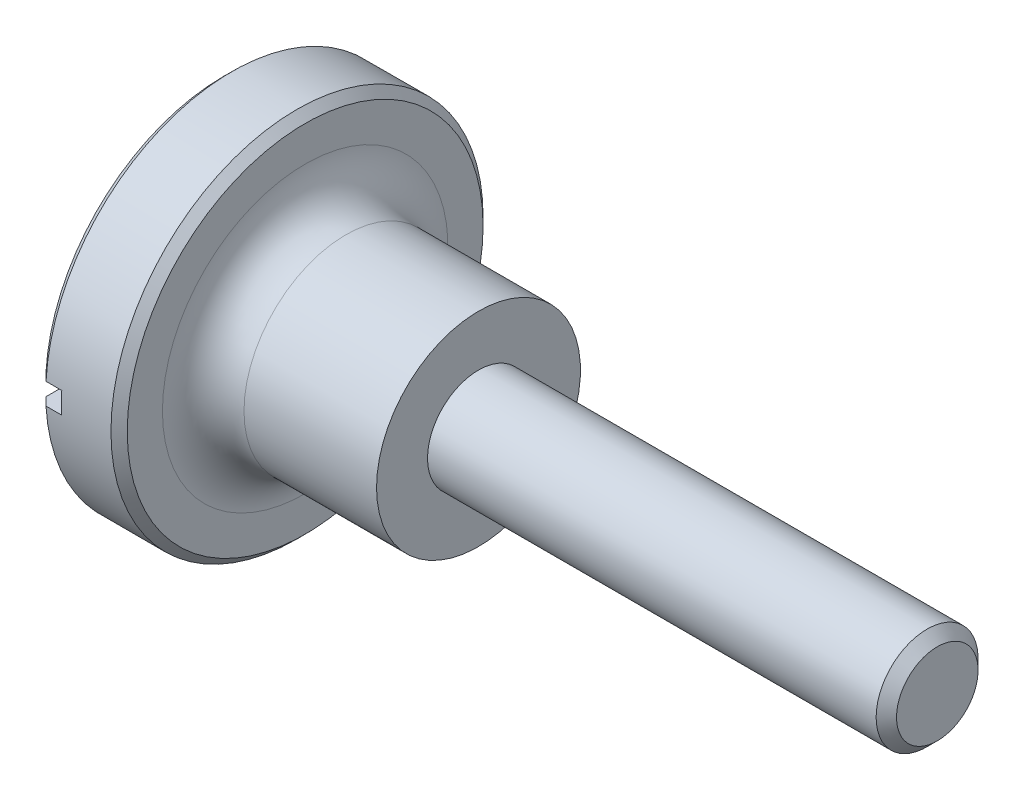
SolidWorks part; units mm, degrees
ref_plane "Plane1" through (0, 0, 0) normal (0, 0, 1) x (1, 0, 0)
ref_plane "Plane2" through (0, 0, 0) normal (0, 1, 0) x (1, 0, 0)
ref_plane "Plane3" through (0, 0, 0) normal (1, 0, 0) x (0, 0, -1)
sketch "BodySke" plane through (0, 0, 0) normal (0, 0, 1) x (1, 0, 0)
  line L0 (69, 5) -> (70, 4)
  line L1 (0, 0) -> (0, 17.45)
  line L2 (-25.4, 0) -> (127, 0) construction
  line L3 (70, 0) -> (0, 0)
  line L5 (70, 4) -> (70, 0)
  line L6 (0.8, 18.25) -> (7.2, 18.25)
  line L7 (4, 31.75) -> (4, -6.35) construction
  line L8 (0.8, 18.25) -> (0, 17.45)
  line L9 (10, 6.5875) -> (10, -2.9375) construction
  line L10 (30, 6.35) -> (30, -3.175) construction
  line L11 (7.2, 18.25) -> (8, 17.45)
  line L12 (8, 10) -> (25, 10)
  line L13 (25, 10) -> (25, 5)
  line L14 (25, 5) -> (69, 5)
  line L15 (8, 10) -> (8, 17.45)
  point P9 (70, 5)
  dimension "D1" = 45
  dimension "D3" = 45
  dimension "Head_ht" = 8
  dimension "Length" = 45
  dimension "Head_dia" = 36.5
  dimension "Advance" = 2
  dimension "Thread_nom" = 40
  dimension "Chamfer" = 0.8
  dimension "Shoulder" = 25
  dimension "diameter" = 10
  dimension "Ds" = 20
  dimension "Minor_dia" = 8
revolve "Base-Revolve" add sketch "BodySke" angle 360 about L2
sketch "ThdSchSke" plane through (0, 0, 0) normal (0, 0, 1) x (1, 0, 0)
  line L0 (30, -4) -> (29.2998, -5)
  line L1 (30, -4) -> (30.7002, -5)
  line L2 (30.7002, -5) -> (30.7002, -6.25)
  line L3 (-3.175, 0) -> (5.1513, 0) construction
  line L5 (30.7002, -6.25) -> (29.2998, -6.25)
  line L6 (29.2998, -6.25) -> (29.2998, -5)
  line L7 (25, -10) -> (25, 10) construction
  dimension "Thread_minor" = 8
  dimension "Diameter" = 10
  dimension "Start" = 5
  dimension "SideAngle" = 55
  dimension "VeeAngle" = 70
  dimension "Overcut" = 12.5
revolve "ThreadSchematic" [suppressed] cut sketch "ThdSchSke" angle 360 about L3
pattern_linear "ThdSchPat" [suppressed]
sketch "KnurlSke" plane through (0, 0, 0) normal (-1, 0, 0) x (0, 0, 1)
  line L0 (0, 17.65) -> (0, 3.175) construction
  line L1 (0, 17.65) -> (0.3445, 18.2467)
  line L2 (0, 17.65) -> (-0.3445, 18.2467)
  line L3 (0, 18.25) -> (0, 17.65) construction
  circle A0 centre (0, 0) radius 18.25 construction
  arc A1 (0.3445, 18.2467) -> (-0.3445, 18.2467) centre (0, 0) ccw
  dimension "D2" = 60
  dimension "depth" = 0.6
extrude "Knurl_cut" [suppressed] cut sketch "KnurlSke" against normal up to next
pattern_circular "Knurl" [suppressed] count 86 over 360 about axis through (-25.4, 0, 0) along (1, 0, 0)
sketch "SlotSke" plane through (0, 0, 0) normal (0, 0, 1) x (1, 0, 0)
  line L0 (2.3466, 1.0507) -> (-2.3466, -1.0507) construction
  line L1 (-2.3466, -1.0507) -> (2.3466, -1.0507)
  line L2 (-2.3466, -1.0507) -> (-2.3466, 1.0507)
  line L3 (-2.3466, 1.0507) -> (2.3466, 1.0507)
  line L4 (2.3466, -1.0507) -> (2.3466, 1.0507)
  dimension "Slot_dep" = 2.3466
  dimension "Slot_Wid" = 2.1014
extrude "Slot" cut sketch "SlotSke" against normal through all and the other way through all
fillet "Fillet1" radius 4 1 edges at (8, 0, 10)
equation "\"Thread_minor@ThreadCosmetic\" = \"Minor_dia@BodySke\""
equation "\"Thread_length@ThreadCosmetic\" = ((sgn( (\"Length@BodySke\" - \"Advance@BodySke\" * 2.0 ) - \"Thread_nom@BodySke\" )-1)*( (\"Length@BodySke\" - \"Advance@BodySke\" * 2.0 ) - \"Thread_nom@BodySke\" ))/-2+ \"Thread_"
equation "\"Thread_minor@ThdSchSke\" = \"Thread_minor@ThreadCosmetic\""
equation "\"Diameter@ThdSchSke\" = \"Diameter@BodySke\""
equation "\"Overcut@ThdSchSke\" = \"Diameter@BodySke\" * 1.25"
equation "\"Start@ThdSchSke\" =  \"Length@BodySke\" -  \"Thread_length@ThreadCosmetic\"  '---Non-countersunk---"
equation "\"Num_threads@ThdSchPat\" = int( \"Thread_length@ThreadCosmetic\" / \"Advance@BodySke\" + 0.999 )  + 1"
equation "\"Advance@ThdSchPat\" = \"Thread_length@ThreadCosmetic\" /  (\"Num_threads@ThdSchPat\" - 1) 'relax it"
equation "\"depth@KnurlSke\" = \"Chamfer@BodySke\" * 0.75"
equation "\"Count@Knurl\" = (3.141592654 / 2 * \"Head_dia@BodySke\") / \"depth@KnurlSke\" * 0.9"
